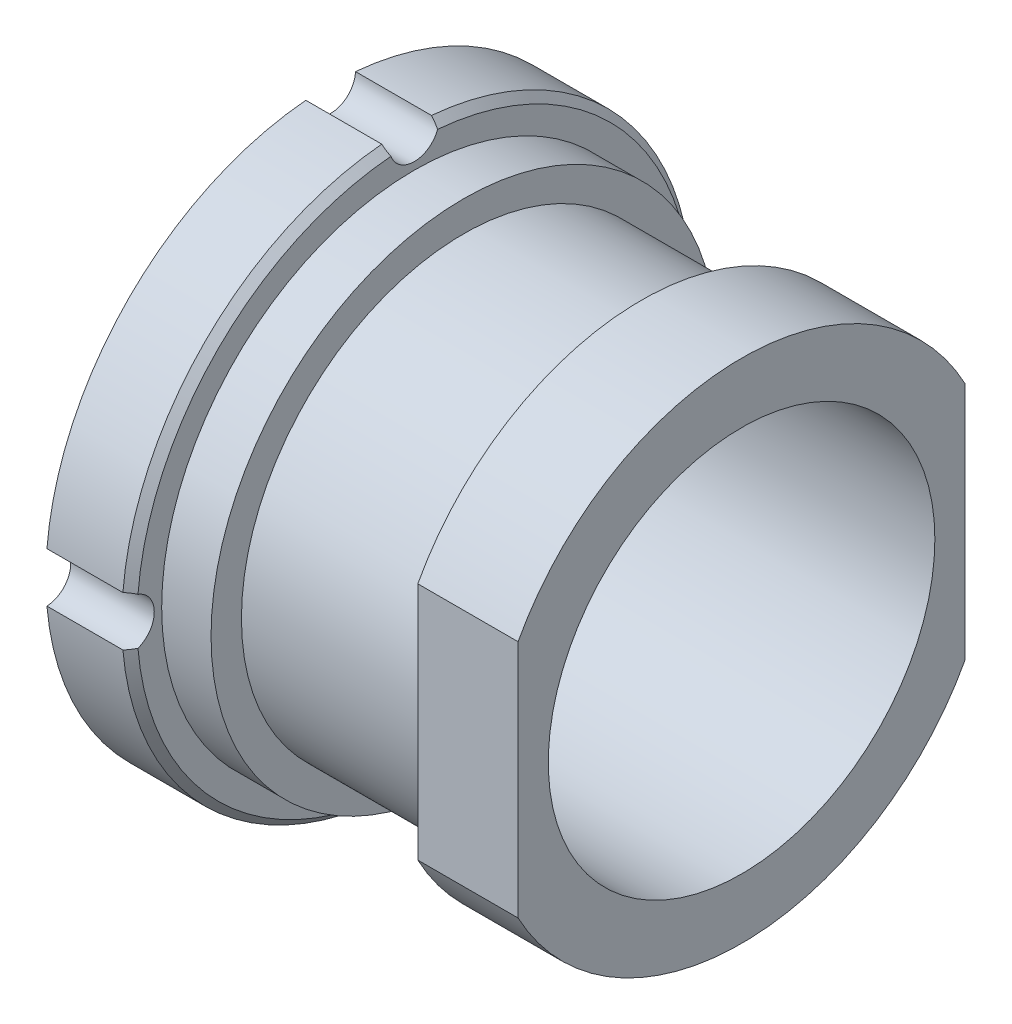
SolidWorks part; units mm, degrees
ref_plane "Front Plane" through (0, 0, 0) normal (0, 0, 1) x (1, 0, 0)
ref_plane "Top Plane" through (0, 0, 0) normal (0, 1, 0) x (1, 0, 0)
ref_plane "Right Plane" through (0, 0, 0) normal (1, 0, 0) x (0, 0, -1)
sketch "Sketch1" plane through (0, 0, 0) normal (1, 0, 0) x (0, 0, -1)
  line L2 (-7.474, 4.0005) -> (-7.474, -4.0005)
  line L4 (7.4739, 4.0005) -> (7.474, -4.0005)
  circle A0 centre (0, 0) radius 6.4643
  arc A1 (-7.474, -4.0005) -> (7.474, -4.0005) centre (0, 0) ccw
  arc A2 (7.4739, 4.0005) -> (-7.474, 4.0005) centre (0, 0) ccw
  dimension "D1" = 12.9286
  dimension "D2" = 16.9545
  dimension "D3" = 7.474
  dimension "D4" = 8.001
extrude "Boss-Extrude1" add sketch "Sketch1" along normal mid plane 13.7414
ref_plane "Plane1" through (3.5179, 0, 0) normal (1, 0, 0) x (0, 0, -1)
sketch "Sketch2" plane through (3.5179, 0, 0) normal (1, 0, 0) x (0, 0, -1)
  circle A0 centre (0, 0) radius 7.4295
  circle A1 centre (0, 0) radius 12.0689
  dimension "D1" = 14.859
extrude "Cut-Extrude1" cut sketch "Sketch2" against normal blind 13.7414
ref_plane "Plane2" through (-2.4257, 0, 0) normal (1, 0, 0) x (0, 0, -1)
sketch "Sketch3" plane through (-2.4257, 0, 0) normal (1, 0, 0) x (0, 0, -1)
  arc A0 (-0.8311, 9.4887) -> (-9.4887, 0.8311) centre (0, 0) ccw
  arc A1 (-0.8311, 9.4887) -> (0.8311, 9.4887) centre (0, 9.525) ccw
  arc A2 (9.4887, 0.8311) -> (9.4887, -0.8311) centre (9.525, 0) ccw
  arc A3 (0.8311, -9.4887) -> (-0.8311, -9.4887) centre (0, -9.525) ccw
  arc A4 (-9.4887, -0.8311) -> (-9.4887, 0.8311) centre (-9.525, 0) ccw
  arc A5 (-9.4887, -0.8311) -> (-0.8311, -9.4887) centre (0, 0) ccw
  arc A6 (0.8311, -9.4887) -> (9.4887, -0.8311) centre (0, 0) ccw
  arc A7 (9.4887, 0.8311) -> (0.8311, 9.4887) centre (0, 0) ccw
  circle A8 centre (0, 0) radius 6.4643 construction
  circle A9 centre (0, 0) radius 6.4643
  point P17 (0, 0)
  dimension "D1" = 19.05
  dimension "D2" = 1.6637
  dimension "D3" = 4
extrude "Boss-Extrude3" add sketch "Sketch3" against normal up to surface (4.445 mm away)
ref_plane "Plane3" through (-2.4257, 0, 0) normal (1, 0, 0) x (0, 0, -1)
sketch "Sketch4" plane through (-2.4257, 0, 0) normal (1, 0, 0) x (0, 0, -1)
  circle A0 centre (0, 0) radius 13.1917
  circle A1 centre (0, 0) radius 8.4455
  dimension "D1" = 16.891
extrude "Cut-Extrude2" cut sketch "Sketch4" against normal blind 1.651
chamfer "Chamfer1" distance 0.254 angle 45 4 edges at (-4.0767, 6.7352, -6.7352) (-4.0767, -6.7352, -6.7352) (-4.0767, -6.7352, 6.7352) (-4.0767, 6.7352, 6.7352)
